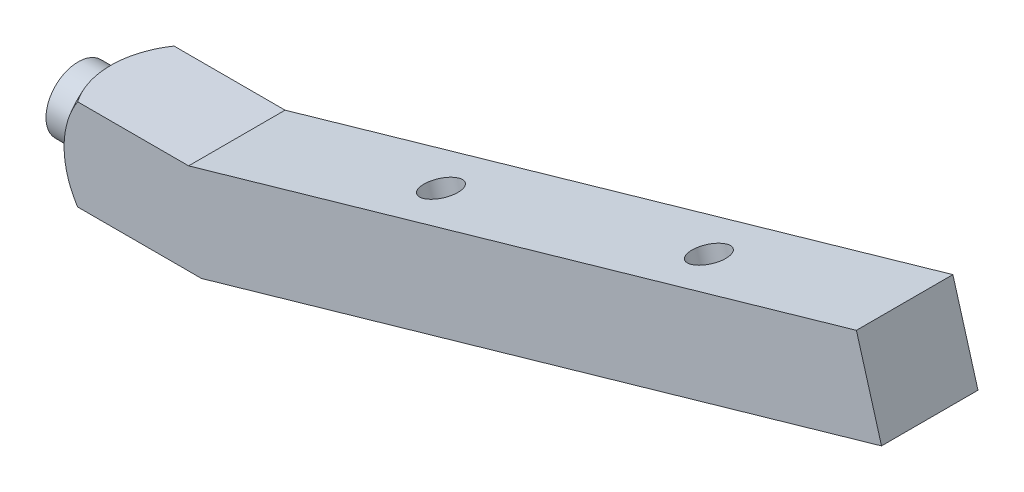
SolidWorks part; units mm, degrees
ref_plane "Face" through (0, 0, 0) normal (0, 0, 1) x (1, 0, 0)
ref_plane "Dessus" through (0, 0, 0) normal (0, 1, 0) x (1, 0, 0)
ref_plane "Droite" through (0, 0, 0) normal (1, 0, 0) x (0, 0, -1)
sketch "Esquisse1" plane through (0, 0, 0) normal (0, 0, 1) x (1, 0, 0)
  line L0 (0, 0) -> (28, 0)
  line L1 (28, 0) -> (154.8865, 36.3841)
  line L2 (154.8865, 36.3841) -> (150.2007, 52.7256)
  line L3 (150.2007, 52.7256) -> (25.6108, 17)
  line L4 (25.6108, 17) -> (0, 17)
  line L5 (0, 17) -> (0, 0)
  dimension "D1" = 17
  dimension "D2" = 17
  dimension "D3" = 132
  dimension "D4" = 16
  dimension "D5" = 28
extrude "Extrusion1" add sketch "Esquisse1" along normal blind 18
ref_plane "Plan1" through (0, 0, 9) normal (0, 0, 1) x (1, 0, 0)
sketch "Esquisse2" plane through (0, 0, 9) normal (0, 0, 1) x (1, 0, 0)
  line L0 (0, 8.5) -> (21.173, 8.5) construction
  line L1 (0, 17) -> (0, 0) construction
  line L2 (17.9706, 26.5) -> (-6.0714, 26.5)
  line L3 (0, 8.5) -> (-6.0714, 8.5)
  line L4 (-6.0714, 26.5) -> (-6.0714, 8.5)
  line L5 (1, 14.5) -> (1, 8.5)
  line L7 (1, 8.5) -> (0, 8.5)
  arc A0 (17.9706, 26.5) -> (1, 14.5) centre (17.9706, 8.5) ccw
  dimension "D1" = 36
  dimension "D2" = 6
revolve "Enlèvement de matière-Révolution3" cut sketch "Esquisse2" angle 360 about L0
sketch "Esquisse3" plane through (1, 0, 0) normal (-1, 0, 0) x (0, 0, 1)
  circle A1 centre (9, 8.5) radius 6
  circle A2 centre (9, 8.5) radius 6
  dimension "D1" = 0
extrude "Extrusion2" add sketch "Esquisse3" along normal blind 5
hole_wizard "Trou taraudé M81" positions "Esquisse5" profile "Esquisse4" tap size "M8" standard "ISO"
sketch "Esquisse5" plane through (-4, 0, 0) normal (-1, 0, 0) x (0, 0, 1)
  circle A0 centre (9, 8.5) radius 6 construction
  point P0 (9, 8.5)
sketch "Esquisse4" plane through (-4, 8.5, 9) normal (0, 1, 0) x (0, 0, 1)
  line L0 (0, 0) -> (0, 30.0429)
  line L1 (0, 30.0429) -> (3.4, 28)
  line L2 (3.4, 28) -> (3.4, 0)
  line L5 (3.4, 0) -> (0, 0)
  line L10 (0, 30.0429) -> (-3.4, 28) construction
  line L11 (0, -6.35) -> (0, 107.95) construction
  dimension "Diamètre du trou pour taraudage" = 6.8
  dimension "Profondeur du trou pour taraudage" = 28
  dimension "Angle de pointe" = 118
hole_wizard "Dégagement M61" positions "Esquisse7" profile "Esquisse6" hole size "M6" standard "ISO"
sketch "Esquisse7" plane through (-2.5585, 8.9226, 0) normal (-0.2756, 0.9613, 0) x (-0.9613, -0.2756, 0)
  line L0 (-158.9153, 0) -> (-29.3045, 0) construction
  line L1 (-158.9153, 18) -> (-158.9153, 0) construction
  point P0 (-68.9153, 9)
  point P1 (-120.9153, 9)
  dimension "D1" = 9
  dimension "D2" = 9
  dimension "D3" = 38
  dimension "D4" = 52
sketch "Esquisse6" plane through (63.6872, 27.9182, 9) normal (0, 0, 1) x (-0.9613, -0.2756, 0)
  line L0 (0, 0) -> (0, 51.9747)
  line L1 (0, 51.9747) -> (3.3, 51.9747)
  line L2 (3.3, 51.9747) -> (3.3, 0)
  line L5 (3.3, 0) -> (0, 0)
  line L11 (0, -6.35) -> (0, 107.95) construction
  dimension "Diamètre du perçage jusqu'au prochain" = 6.6
  dimension "Profondeur du perçage jusqu'au prochain" = 51.9747
